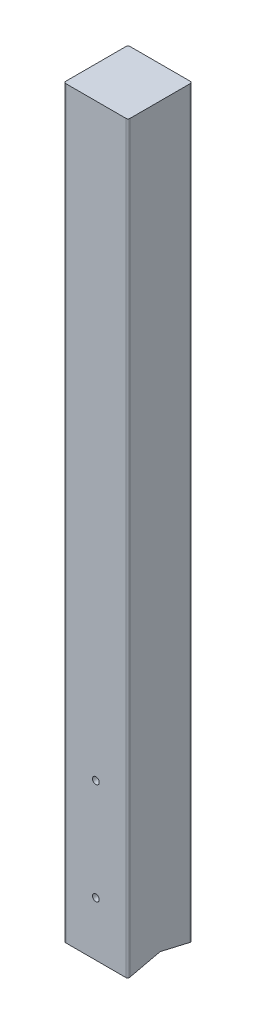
SolidWorks part; units mm, degrees
ref_plane "Front Plane" through (0, 0, 0) normal (0, 0, 1) x (1, 0, 0)
ref_plane "Top Plane" through (0, 0, 0) normal (0, 1, 0) x (1, 0, 0)
ref_plane "Right Plane" through (0, 0, 0) normal (1, 0, 0) x (0, 0, -1)
sketch "Layout tvärsnitt" plane through (0, 0, 0) normal (0, 1, 0) x (1, 0, 0)
  line L0 (0, -47.5) -> (0, 47.5) construction
  line L1 (-47.5, 47.5) -> (47.5, 47.5)
  line L2 (-47.5, 47.5) -> (-47.5, -47.5)
  line L3 (-47.5, -47.5) -> (47.5, -47.5)
  line L4 (47.5, 47.5) -> (47.5, -47.5)
  dimension "D1" = 95
sketch "Sketch slits" plane through (0, 0, 0) normal (0, 1, 0) x (1, 0, 0)
  line L0 (47.5, 47.5) -> (47.5, -47.5) construction
  line L1 (-47.5, 4.5) -> (47.5, 4.5)
  line L2 (-47.5, 4.5) -> (-47.5, -4.5)
  line L3 (-47.5, -4.5) -> (47.5, -4.5)
  line L4 (47.5, 4.5) -> (47.5, -4.5)
  line L6 (47.5, 0) -> (-47.5, 0)
  dimension "D1" = 9
sketch "Sketch slitshöjd och skruvhål" plane through (0, 0, 0) normal (0, 0, 1) x (1, 0, 0)
  line L0 (0, 0) -> (0, 290) construction
  circle A0 centre (0, 230) radius 5
  circle A1 centre (0, 80) radius 5
  dimension "D2" = 10
  dimension "D1" = 290
  dimension "D3" = 80
  dimension "D4" = 150
sketch "Sketch3" plane through (0, 0, 0) normal (0, 1, 0) x (1, 0, 0)
  line L0 (47.5, 47.5) -> (47.5, -47.5) construction
  line L1 (-47.5, -47.5) -> (47.5, -47.5) construction
  line L2 (-47.5, 47.5) -> (47.5, 47.5) construction
  line L3 (-47.5, 47.5) -> (-47.5, -47.5) construction
  line L4 (47.5, 47.5) -> (47.5, -47.5)
  line L5 (-47.5, -47.5) -> (47.5, -47.5)
  line L6 (-47.5, 47.5) -> (47.5, 47.5)
  line L7 (-47.5, 47.5) -> (-47.5, -47.5)
extrude "Extrude längd" add sketch "Sketch3" along normal blind 1100
sketch "Sketch4" plane through (0, 0, 0) normal (0, 1, 0) x (1, 0, 0)
  line L0 (47.5, 4.5) -> (47.5, -4.5) construction
  line L1 (-47.5, 4.5) -> (-47.5, -4.5) construction
  line L2 (-47.5, -4.5) -> (47.5, -4.5) construction
  line L3 (-47.5, 4.5) -> (47.5, 4.5) construction
  line L4 (47.5, 4.5) -> (47.5, -4.5)
  line L5 (-47.5, 4.5) -> (-47.5, -4.5)
  line L6 (-47.5, -4.5) -> (47.5, -4.5)
  line L7 (-47.5, 4.5) -> (47.5, 4.5)
extrude "Cut slits" cut sketch "Sketch4" along normal up to vertex
sketch "Sketch5" plane through (0, 0, 0) normal (0, 0, 1) x (1, 0, 0)
  circle A0 centre (0, 80) radius 5 construction
  circle A1 centre (0, 230) radius 5 construction
  circle A2 centre (0, 80) radius 5
  circle A3 centre (0, 230) radius 5
extrude "Cut skruvhål" cut sketch "Sketch5" against normal up to next and the other way up to next
sketch "Sketch6" plane through (0, 0, 0) normal (1, 0, 0) x (0, 0, -1)
  line L1 (0, 0) -> (0, 290) construction
  line L2 (0, 11) -> (-47.5, 0)
  line L4 (0, 0) -> (0, 11) construction
  line L5 (47.5, 0) -> (0, 11)
  dimension "D1" = 11
extrude "Cut lutande botten" cut sketch "Sketch6" against normal through all and the other way through all
sketch "Sketch7" plane through (0, 0, 0) normal (0, 1, 0) x (1, 0, 0)
  circle A0 centre (0, 0) radius 32.5
  dimension "D1" = 65
extrude "Cut urtag rörfot" cut sketch "Sketch7" along normal blind 290
sketch "Sketch8" plane through (0, 0, 0) normal (0, 1, 0) x (1, 0, 0)
  line L0 (47.5, 27.5) -> (45.5, 27.5)
  line L1 (-27.5, -47.5) -> (-27.5, -45.5)
  line L2 (-47.5, -47.5) -> (47.5, -47.5) construction
  line L3 (-15.5, -45.5) -> (-15.5, -47.5)
  line L4 (15.5, -47.5) -> (15.5, -45.5)
  line L5 (27.5, -45.5) -> (27.5, -47.5)
  line L6 (47.5, -27.5) -> (45.5, -27.5)
  line L7 (47.5, 47.5) -> (47.5, -47.5) construction
  line L8 (45.5, -15.5) -> (47.5, -15.5)
  line L9 (45.5, 15.5) -> (47.5, 15.5)
  line L11 (-27.5, -47.5) -> (-15.5, -47.5)
  line L12 (15.5, -47.5) -> (27.5, -47.5)
  line L13 (47.5, -27.5) -> (47.5, -15.5)
  line L14 (47.5, 15.5) -> (47.5, 27.5)
  line L19 (47.5, 0) -> (-48.2457, 0) construction
  line L20 (0, -47.5) -> (0, 47.5) construction
  line L21 (27.5, 45.5) -> (27.5, 47.5)
  line L22 (15.5, 47.5) -> (27.5, 47.5)
  line L23 (15.5, 47.5) -> (15.5, 45.5)
  line L24 (-15.5, 45.5) -> (-15.5, 47.5)
  line L25 (-27.5, 47.5) -> (-15.5, 47.5)
  line L26 (-27.5, 47.5) -> (-27.5, 45.5)
  line L27 (-47.5, 27.5) -> (-45.5, 27.5)
  line L28 (-45.5, 15.5) -> (-47.5, 15.5)
  line L29 (-47.5, 15.5) -> (-47.5, 27.5)
  line L30 (-47.5, -27.5) -> (-47.5, -15.5)
  line L31 (-45.5, -15.5) -> (-47.5, -15.5)
  line L32 (-47.5, -27.5) -> (-45.5, -27.5)
  arc A0 (-27.5, -45.5) -> (-15.5, -45.5) centre (-21.5, -45.5) cw
  arc A1 (15.5, -45.5) -> (27.5, -45.5) centre (21.5, -45.5) cw
  arc A2 (45.5, -27.5) -> (45.5, -15.5) centre (45.5, -21.5) cw
  arc A3 (45.5, 27.5) -> (45.5, 15.5) centre (45.5, 21.5) ccw
  arc A4 (15.5, 45.5) -> (27.5, 45.5) centre (21.5, 45.5) ccw
  arc A5 (-27.5, 45.5) -> (-15.5, 45.5) centre (-21.5, 45.5) ccw
  arc A6 (-45.5, 27.5) -> (-45.5, 15.5) centre (-45.5, 21.5) cw
  arc A7 (-45.5, -27.5) -> (-45.5, -15.5) centre (-45.5, -21.5) ccw
  dimension "D1" = 2
  dimension "spårradie" = 6
  dimension "kantavstånd" = 20
extrude "Cut kolonner" cut sketch "Sketch8" along normal through all
fillet "Fillet kanter" radius 3 4 edges at (47.5, 550, -47.5) (47.5, 550, 47.5) (-47.5, 550, 47.5) (-47.5, 550, -47.5)
